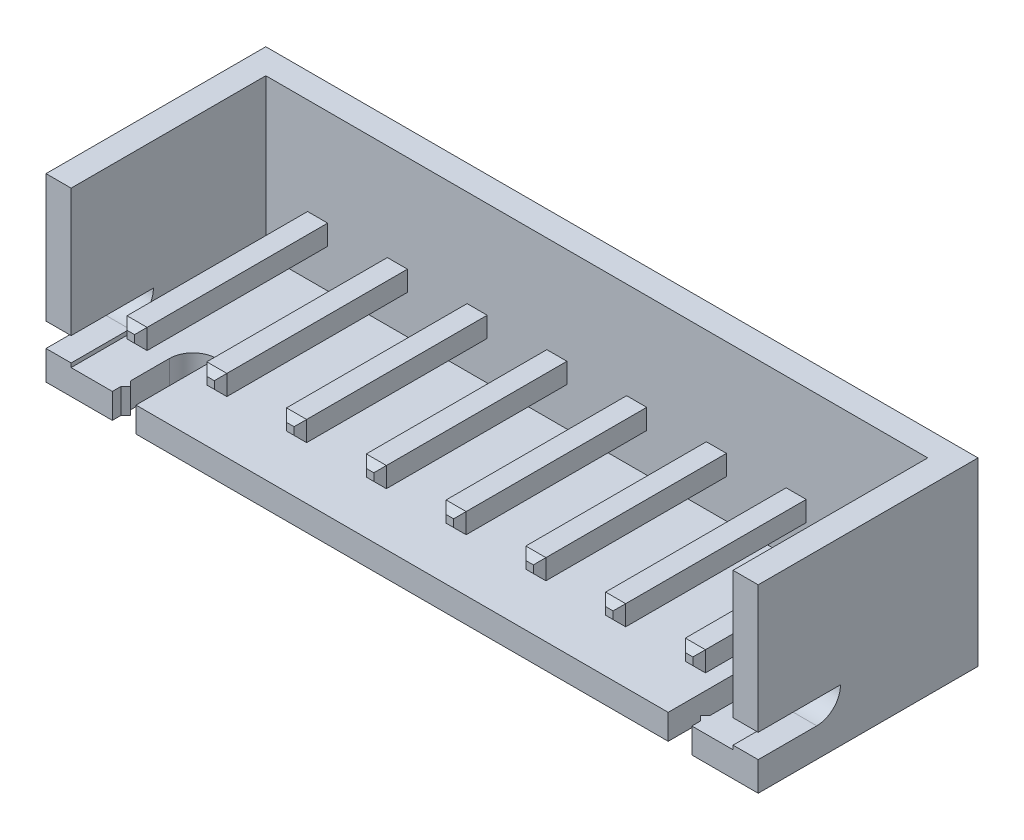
SolidWorks part; units mm, degrees
ref_plane "Front Plane" through (0, 0, 0) normal (0, 0, 1) x (1, 0, 0)
ref_plane "Top Plane" through (0, 0, 0) normal (0, 1, 0) x (1, 0, 0)
ref_plane "Right Plane" through (0, 0, 0) normal (1, 0, 0) x (0, 0, -1)
imported_body "Plastic Housing-1/Plastic Housing-1-solid1"
imported_body "Plastic Housing-1/Pins-1-solid1"
imported_body "Plastic Housing-1/Pins-1-solid2"
imported_body "Plastic Housing-1/Pins-1-solid3"
imported_body "Plastic Housing-1/Pins-1-solid4"
imported_body "Plastic Housing-1/Pins-1-solid5"
imported_body "Plastic Housing-1/Pins-1-solid6"
imported_body "Plastic Housing-1/Pins-1-solid7"
imported_body "Plastic Housing-1/Pins-1-solid8"
sketch "Sketch1" plane through (0, 2.875, 0) normal (0, 1, 0) x (1, 0, 0)
  line L1 (-10.54, -0.8) -> (10.54, -0.8)
  line L2 (-10.54, -0.8) -> (-10.54, -7)
  line L3 (-10.54, -7) -> (10.54, -7)
  line L4 (10.54, -0.8) -> (10.54, -7)
extrude "Cut-Extrude1" cut sketch "Sketch1" against normal up to next
sketch "Sketch2" plane through (0, -0.205, 0) normal (0, 1, 0) x (1, 0, 0)
  line L0 (-9.21, -6.55) -> (-9.21, 3.25) construction
  line L1 (-9.21, 1.27) -> (9.21, 1.27)
  line L2 (-9.21, 1.27) -> (-9.21, 3.45)
  line L3 (-9.21, 3.45) -> (9.21, 3.45)
  line L4 (9.21, 1.27) -> (9.21, 3.45)
  line L5 (9.21, -6.55) -> (9.21, 3.25) construction
  line L6 (8.77, 3.45) -> (9.01, 3.45) construction
  line L7 (11.34, 0) -> (-11.34, 0) construction
  dimension "D1" = 1.27
extrude "Cut-Extrude2" cut sketch "Sketch2" against normal through all
sketch "Sketch3" plane through (0, -0.205, 0) normal (0, 1, 0) x (1, 0, 0)
  line L0 (-8.57, -6.55) -> (-8.57, 1.27) construction
  line L1 (-9.21, 1.27) -> (-8.57, 1.27)
  line L2 (-9.21, 1.27) -> (-9.21, 1.91)
  line L3 (-9.21, 1.91) -> (-8.57, 1.91)
  line L4 (-8.57, 1.27) -> (-8.57, 1.91)
extrude "Boss-Extrude1" add sketch "Sketch3" against normal offset from surface (4.448 mm away) 1.778
pattern_linear "LPattern1" count 8 spacing 2.54 along (1, 0, 0) of "Boss-Extrude1"
